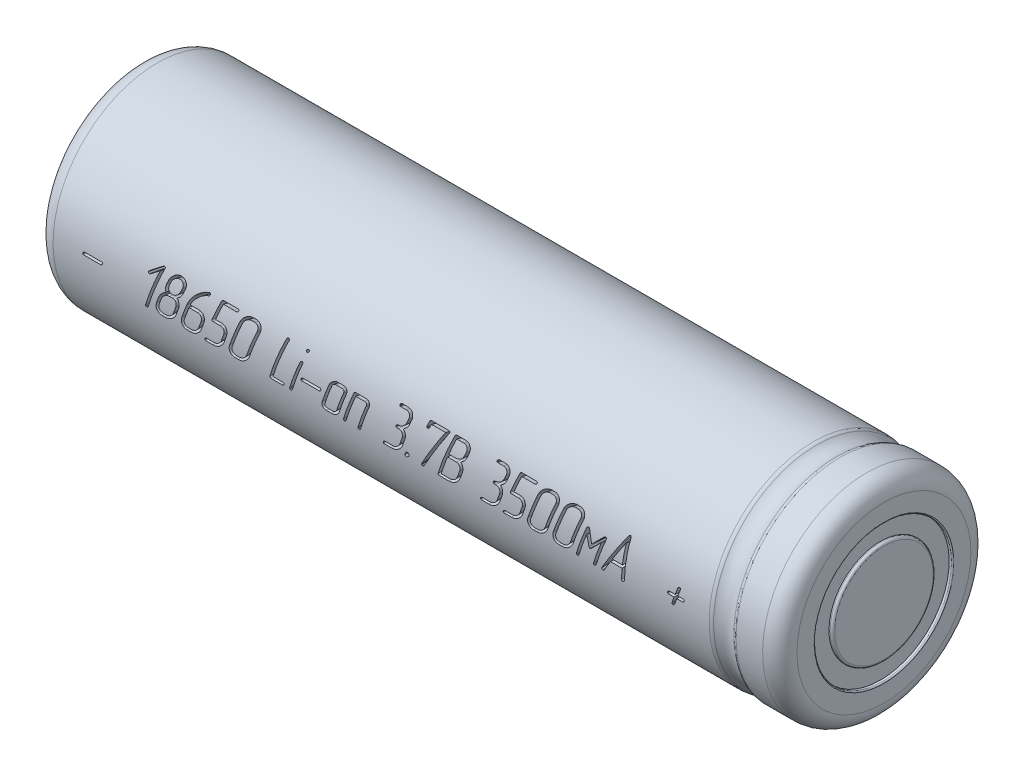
SolidWorks part; units mm, degrees
ref_plane "Спереди (Плоскость XY)" through (0, 0, 0) normal (0, 0, 1) x (1, 0, 0)
ref_plane "Сверху (Плоскость XZ)" through (0, 0, 0) normal (0, 1, 0) x (1, 0, 0)
ref_plane "Справа )Плоскость XY)" through (0, 0, 0) normal (1, 0, 0) x (0, 0, -1)
sketch "Эскиз1" plane through (0, 0, 0) normal (0, 0, 1) x (1, 0, 0)
  line L0 (0, 0) -> (0, -6)
  line L5 (0, -6) -> (-0.3, -6)
  line L6 (-0.3, -6) -> (-0.3, -9.1)
  line L7 (-0.3, -9.1) -> (58.7, -9.1)
  line L8 (64.7, -9.1) -> (64.7, -6)
  line L9 (64.7, -6) -> (64.4, -6)
  line L10 (64.4, -6) -> (64.4, -4.5)
  line L11 (64.4, -4.5) -> (64.7, -4.5)
  line L12 (64.7, -4.5) -> (64.7, 0)
  line L13 (0, 0) -> (64.7, 0) construction
  line L14 (0, 0) -> (64.7, 0)
  line L15 (60.7, -9.1) -> (64.7, -9.1)
  arc A0 (58.7, -9.1) -> (60.7, -9.1) centre (59.7, -10.218) cw
  point P0 (0, 0)
  dimension "D1" = 65
  dimension "D9" = 1.5
  dimension "D2" = 6
  dimension "D3" = 0.3
  dimension "D4" = 0.3
  dimension "D5" = 9.1
  dimension "D6" = 6
  dimension "D7" = 4.5
  dimension "D8" = 0.3
  dimension "D10" = 4
  dimension "D11" = 2
revolve "Повернуть1" add sketch "Эскиз1" angle 360 about L13
fillet "Скругление2" radius 1.5 2 edges at (-0.3, -9.1, 0) (64.7, -9.1, 0)
fillet "Скругление3" radius 0.1 2 edges at (64.7, -6, 0) (-0.3, -6, 0)
fillet "Скругление4" radius 0.2 1 edges at (64.7, -4.5, 0)
fillet "Скругление5" radius 0.5 2 edges at (60.7, -9.1, 0) (58.7, -9.1, 0)
sketch "Эскиз5" plane through (0, 0, 0) normal (0, 0, 1) x (1, 0, 0)
  text T0 " -  18650 Li-on 3.7В 3500мА  +"
wrap "Перенос3" sketch "Эскиз5" wrap type deboss source sketch "Эскиз5" thickness 2 parameters "D1"=2
